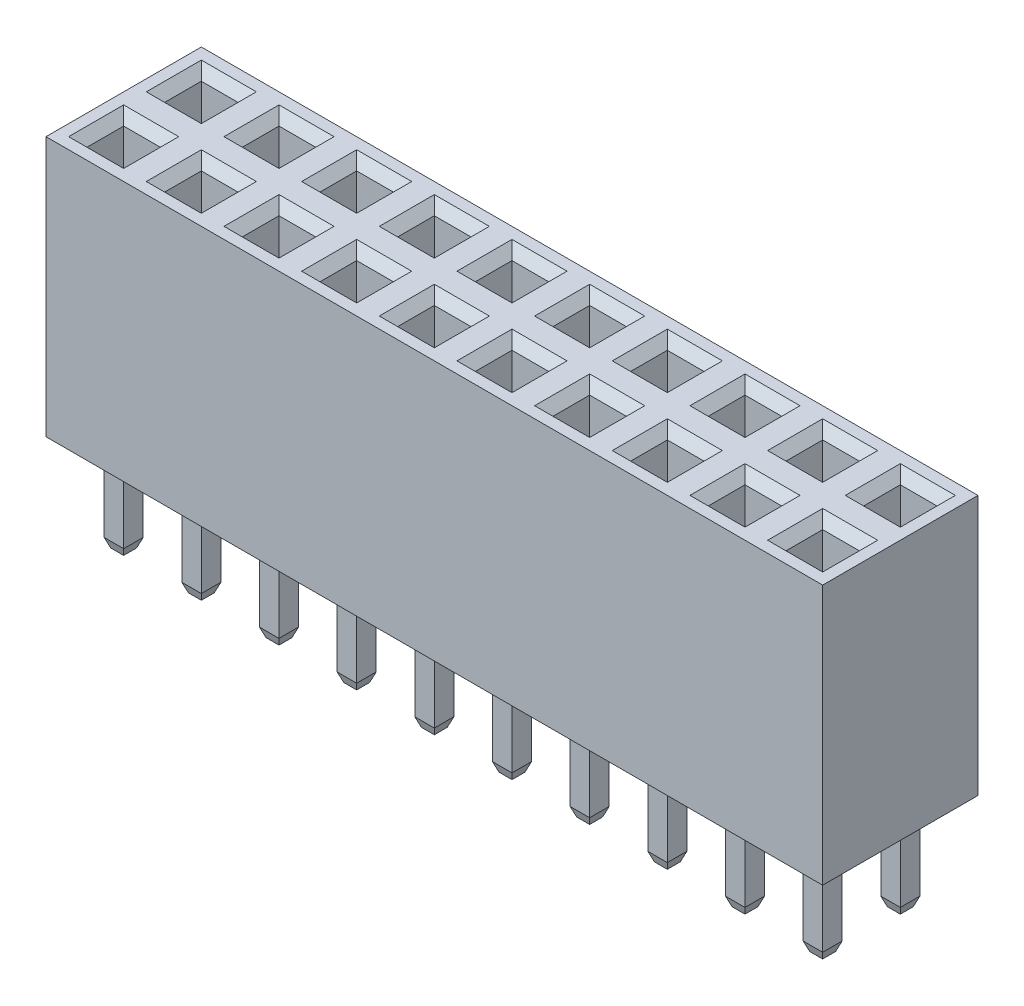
SolidWorks part; units mm, degrees
ref_plane "Front" through (0, 0, 0) normal (0, 0, 1) x (1, 0, 0)
ref_plane "Top" through (0, 0, 0) normal (0, 1, 0) x (1, 0, 0)
ref_plane "Right" through (0, 0, 0) normal (1, 0, 0) x (0, 0, -1)
sketch "Эскиз2" plane through (0, 0, 0) normal (0, 1, 0) x (1, 0, 0)
  line L1 (-1.27, 3.81) -> (1.27, 3.81)
  line L2 (-1.27, 3.81) -> (-1.27, -1.27)
  line L3 (-1.27, -1.27) -> (1.27, -1.27)
  line L4 (1.27, 3.81) -> (1.27, -1.27)
  line L8 (0, -1.27) -> (0, 3.81) construction
  dimension "D1" = 2.54
  dimension "D2" = 5.08
  dimension "D3" = 1.27
extrude "Вытянуть2" add sketch "Эскиз2" along normal blind 8.5
sketch "Эскиз3" plane through (0, 8.5, 0) normal (0, 1, 0) x (-1, 0, 0)
  line L0 (0, 0.6) -> (0, -0.6) construction
  line L1 (0.6, 0.6) -> (-0.6, 0.6)
  line L2 (0.6, 0.6) -> (0.6, -0.6)
  line L3 (0.6, -0.6) -> (-0.6, -0.6)
  line L4 (-0.6, 0.6) -> (-0.6, -0.6)
  line L5 (0.6, -1.94) -> (-0.6, -1.94)
  line L6 (0.6, -1.94) -> (0.6, -3.14)
  line L7 (0.6, -3.14) -> (-0.6, -3.14)
  line L8 (-0.6, -1.94) -> (-0.6, -3.14)
  line L9 (0, -1.94) -> (0, -3.14) construction
  dimension "D1" = 1.2
  dimension "D2" = 2.54
extrude "Вырез-Вытянуть1" cut sketch "Эскиз3" against normal blind 6.2
chamfer "Фаска3" distance 0.3 angle 45 8 edges at (-0.6, 8.5, 0) (0, 8.5, 0.6) (0.6, 8.5, 0) (0, 8.5, -0.6) (0, 8.5, -1.94) (0.6, 8.5, -2.54) (0, 8.5, -3.14) (-0.6, 8.5, -2.54)
sketch "Эскиз1" plane through (0, 0, 0) normal (0, 1, 0) x (1, 0, 0)
  line L0 (-0.32, 0) -> (0.32, 0) construction
  line L1 (-0.32, 0.32) -> (0.32, 0.32)
  line L2 (-0.32, 0.32) -> (-0.32, -0.32)
  line L3 (-0.32, -0.32) -> (0.32, -0.32)
  line L4 (0.32, 0.32) -> (0.32, -0.32)
  line L5 (-0.32, 2.86) -> (0.32, 2.86)
  line L6 (-0.32, 2.86) -> (-0.32, 2.22)
  line L7 (-0.32, 2.22) -> (0.32, 2.22)
  line L8 (0.32, 2.86) -> (0.32, 2.22)
  line L9 (-0.32, 2.54) -> (0.32, 2.54) construction
  dimension "D1" = 0.64
  dimension "D2" = 2.54
extrude "Вытянуть1" add sketch "Эскиз1" against normal blind 3.15
chamfer "Фаска1" distance 0.3 angle 20 8 edges at (0, -3.15, -0.32) (0.32, -3.15, 0) (0, -3.15, 0.32) (-0.32, -3.15, 0) (0, -3.15, -2.22) (0.32, -3.15, -2.54) (0, -3.15, -2.86) (-0.32, -3.15, -2.54)
pattern_linear "Линейный массив1" count 10 spacing 2.54 along (-1, 0, 0) of "Вытянуть2", "Вырез-Вытянуть1", "Фаска3"
pattern_linear "Линейный массив3" count 100 spacing 2.54 along (-1, 0, 0) of "Вытянуть1", "Фаска1"
